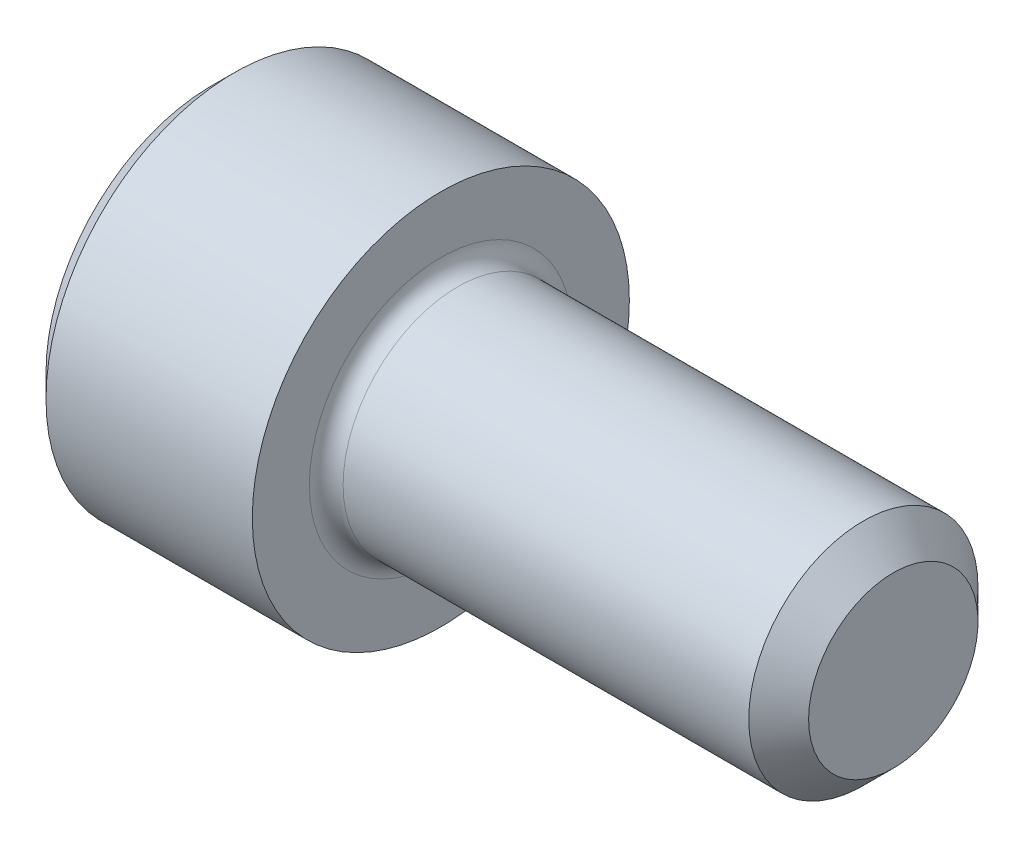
SolidWorks part; units mm, degrees
ref_plane "Plane1" through (0, 0, 0) normal (0, 0, 1) x (1, 0, 0)
ref_plane "Plane2" through (0, 0, 0) normal (0, 1, 0) x (1, 0, 0)
ref_plane "Plane3" through (0, 0, 0) normal (1, 0, 0) x (0, 0, -1)
sketch "BodySke" plane through (0, 0, 0) normal (0, 0, 1) x (1, 0, 0)
  line L0 (0, 0) -> (0, 3.4861)
  line L1 (0.4826, 3.9688) -> (4.826, 3.9688)
  line L2 (4.826, 3.9688) -> (4.826, 2.413)
  line L3 (4.826, 2.413) -> (13.7211, 2.413)
  line L4 (14.351, 1.7831) -> (14.351, 0)
  line L5 (14.351, 0) -> (0, 0)
  line L6 (-31.75, 0) -> (127, 0) construction
  line L7 (0, 3.4861) -> (0.4826, 3.9688)
  line L8 (14.351, 1.7831) -> (13.7211, 2.413)
  line L9 (0, -3.4861) -> (0.4826, -3.9688) construction
  line L10 (14.351, -1.7831) -> (13.7211, -2.413) construction
  line L11 (5.8852, 9.525) -> (5.8852, 3.175) construction
  line L12 (4.826, 9.525) -> (4.826, 3.175) construction
  line L13 (-23.749, 9.525) -> (-23.749, 3.175) construction
  dimension "Diameter" = 4.826
  dimension "Head_ht" = 4.826
  dimension "Length" = 9.525
  dimension "Body_ch_ang" = 45
  dimension "Head_dia" = 7.9375
  dimension "Head_ch_ang" = 45
  dimension "Head_side_ht" = 4.3434
  dimension "Minor_dia" = 3.5662
  dimension "Advance" = 1.0592
  dimension "Thread_nom" = 9.525
  dimension "Thread_length" = 38.1
revolve "Base-Revolve" add sketch "BodySke"
fillet "Fillet1" radius 0.3556
sketch "Sketch2" plane through (0, 0, 0) normal (0, 0, 1) x (1, 0, 0)
  line L0 (0, 1.985) -> (2.286, 1.985)
  line L1 (2.286, 1.985) -> (3.432, 0)
  line L2 (-31.75, 0) -> (127, 0) construction
  line L3 (3.432, 0) -> (0, 0)
  line L4 (0, 0) -> (0, 1.985)
  line L5 (0, 3.4861) -> (0, -3.4861) construction
  line L6 (0, 0) -> (47.625, 0) construction
  line L7 (4.826, -3.9688) -> (4.826, 3.9688) construction
  dimension "D1" = 1.985
  dimension "D2" = 60
  dimension "Wall_thickness" = 2.54
revolve "Hex-PreBroach" cut sketch "Sketch2" angle 360 about L6
sketch "Sketch3" plane through (0, 0, 0) normal (-1, 0, 0) x (0, 0.5, 0.866)
  line L0 (1.146, 1.985) -> (-1.146, 1.985)
  line L1 (-1.146, 1.985) -> (-2.2921, 0)
  line L2 (1.146, 1.985) -> (2.2921, 0)
  line L3 (1.146, -1.985) -> (2.2921, 0)
  line L4 (1.146, -1.985) -> (-1.146, -1.985)
  line L5 (-1.146, -1.985) -> (-2.2921, 0)
  dimension "D1" = 1.985
  dimension "D2" = 1.985
  dimension "Hex_size" = 3.97
extrude "Hex" cut sketch "Sketch3" against normal blind 2.286
sketch "Sketch4" plane through (0, 0, 0) normal (-1, 0, 0) x (0, 0, 1)
  line L0 (0, 0) -> (2.3876, 0)
  line L1 (0, 0) -> (6.1484, 3.5498) construction
  line L2 (0, 0) -> (1.1938, 2.0677)
  line L3 (1.9883, 0.576) -> (2.2704, 0.7389)
  line L4 (1.493, 1.4339) -> (1.7751, 1.5968)
  arc A0 (1.9883, 0.576) -> (1.493, 1.4339) centre (0, 0) ccw
  arc A1 (2.3876, 0) -> (2.2704, 0.7389) centre (0, 0) ccw
  arc A2 (1.1938, 2.0677) -> (1.7751, 1.5968) centre (0, 0) cw
  dimension "D1" = 30
  dimension "Spline_n_dim" = 4.1402
  dimension "Spline_m_dim" = 4.7752
  dimension "D2" = 60
  dimension "D3" = 0.4953
  dimension "Spline_p_dim" = 0.9906
extrude "Spline" [suppressed] cut sketch "Sketch4" against normal blind 2.286
pattern_circular "CirPattern1" [suppressed] count 6 every 60
sketch "Sketch5" plane through (0, 0, 0) normal (0, 0, 1) x (1, 0, 0)
  line L0 (-31.75, 0) -> (127, 0) construction
  line L1 (0, -1.146) -> (0, 1.146) construction
  line L2 (0, 3.4861) -> (0, -3.4861) construction
  circle A0 centre (1.651, 0) radius 0.5905
  dimension "Drilled_hole_dia" = 1.1811
  dimension "Drilled_hole_loc" = 1.651
extrude "Hole" [suppressed] cut sketch "Sketch5" against normal through all and the other way through all
pattern_circular "Drilled-4" [suppressed] count 2 every 60
pattern_circular "Drilled-6" [suppressed] count 3 every 60
sketch "ThdSchSke" plane through (0, 0, 0) normal (0, 0, 1) x (1, 0, 0)
  line L0 (5.8852, -1.7831) -> (5.4441, -2.413)
  line L1 (5.8852, -1.7831) -> (6.3263, -2.413)
  line L2 (6.3263, -2.413) -> (6.3263, -3.0162)
  line L3 (-3.175, 0) -> (5.1513, 0) construction
  line L5 (6.3263, -3.0162) -> (5.4441, -3.0162)
  line L6 (5.4441, -3.0162) -> (5.4441, -2.413)
  line L7 (0, 3.4861) -> (0, -3.4861) construction
  dimension "Thread_minor" = 3.5662
  dimension "Diameter" = 4.826
  dimension "Start" = 5.8852
  dimension "SideAngle" = 55
  dimension "VeeAngle" = 70
  dimension "Overcut" = 6.0325
revolve "ThreadSchematic" [suppressed] cut sketch "ThdSchSke" angle 360 about L3
pattern_linear "ThdSchPat" [suppressed]
equation "\"D2@Sketch3\" = \"Hex_size@Sketch3\" / 2"
equation "\"D1@Sketch3\" = \"Hex_size@Sketch3\" / 2"
equation "\"D1@Sketch2\" = \"Hex_size@Sketch3\" / 2"
equation "\"D3@Sketch4\" = \"Spline_p_dim@Sketch4\" / 2"
equation "\"Thread_minor@ThreadCosmetic\"  =  \"Minor_dia@BodySke\""
equation "\"D2@CirPattern1\" = 360 / \"Num_teeth@CirPattern1\""
equation "\"Wall_thickness@Sketch2\" = \"Head_ht@BodySke\" - \"Key_eng@Hex\""
equation "\"Thread_length@ThreadCosmetic\" = ((sgn( (\"Length@BodySke\" - \"Advance@BodySke\" ) - \"Thread_nom@BodySke\" )-1)*( (\"Length@BodySke\" - \"Advance@BodySke\" ) - \"Thread_nom@BodySke\" ))/-2+ \"Thread_nom@BodySke\""
equation "\"Thread_minor@ThdSchSke\" = \"Minor_dia@BodySke\""
equation "\"Diameter@ThdSchSke\" = \"Diameter@BodySke\""
equation "\"Overcut@ThdSchSke\" = \"Diameter@BodySke\" * 1.25"
equation "\"Start@ThdSchSke\" = \"Head_ht@BodySke\" + \"Length@BodySke\" - \"Thread_length@ThreadCosmetic\"  '---Non-countersunk---"
equation "\"Num_threads@ThdSchPat\" = int( \"Thread_length@ThreadCosmetic\" / \"Advance@BodySke\" + 0.999 )  + 1"
equation "\"Advance@ThdSchPat\" = \"Thread_length@ThreadCosmetic\" /  (\"Num_threads@ThdSchPat\" - 1) 'relax it"
equation "\"Num_threads@ThdSchPat\" = \"Num_threads@ThdSchPat\" - sgn( \"Num_threads@ThdSchPat\" - 1) '---chamfered tips only---"
